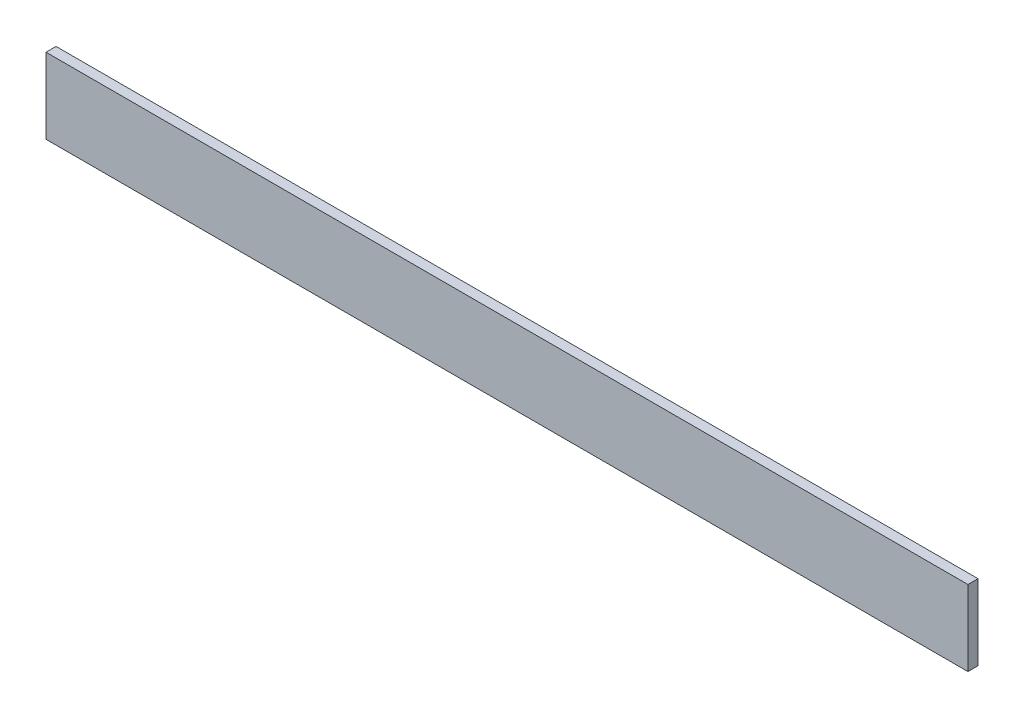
SolidWorks part; units mm, degrees
ref_plane "Front Plane" through (0, 0, 0) normal (0, 0, 1) x (1, 0, 0)
ref_plane "Top Plane" through (0, 0, 0) normal (0, 1, 0) x (1, 0, 0)
ref_plane "Right Plane" through (0, 0, 0) normal (1, 0, 0) x (0, 0, -1)
sketch "Sketch1" plane through (0, 0, 0) normal (0, 0, 1) x (1, 0, 0)
  line L1 (-550, 45) -> (550, 45)
  line L2 (-550, 45) -> (-550, -45)
  line L3 (-550, -45) -> (550, -45)
  line L4 (550, 45) -> (550, -45)
  line L5 (-550, 45) -> (550, -45) construction
  line L6 (-550, -45) -> (550, 45) construction
  point P0 (0, 0)
  dimension "D1" = 90
  dimension "D2" = 1100
extrude "Boss-Extrude2" add sketch "Sketch1" along normal blind 12
